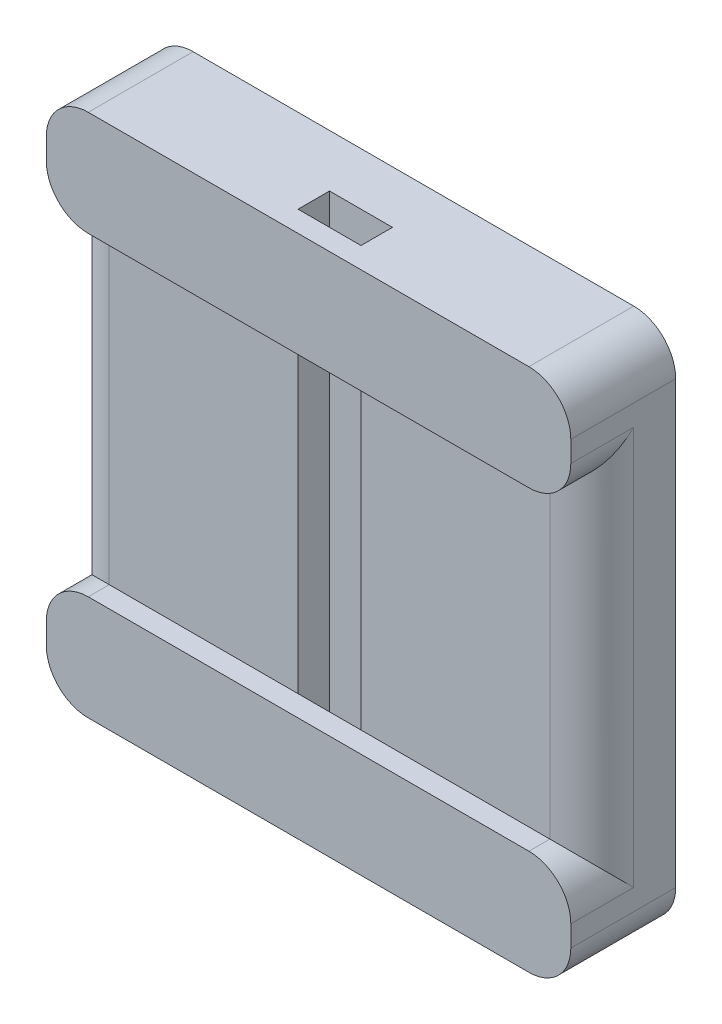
SolidWorks part; units mm, degrees
ref_plane "Plan de face" through (0, 0, 0) normal (0, 0, 1) x (1, 0, 0)
ref_plane "Plan de dessus" through (0, 0, 0) normal (0, 1, 0) x (1, 0, 0)
ref_plane "Plan de droite" through (0, 0, 0) normal (1, 0, 0) x (0, 0, -1)
sketch "Esquisse1" plane through (0, 0, 0) normal (0, 0, 1) x (1, 0, 0)
  line L1 (0, 0) -> (25, 0)
  line L2 (0, 0) -> (0, 25)
  line L3 (0, 25) -> (25, 25)
  line L4 (25, 0) -> (25, 25)
  dimension "D1" = 25
  dimension "D2" = 25
extrude "Boss.-Extru.1" add sketch "Esquisse1" along normal blind 4
sketch "Esquisse2" plane through (0, 0, 4) normal (0, 0, 1) x (1, 0, 0)
  line L0 (0, 20) -> (25, 20)
  line L1 (0, 25) -> (0, 0) construction
  line L2 (25, 0) -> (25, 25) construction
  line L3 (25, 20) -> (25, 25)
  line L4 (25, 25) -> (0, 25)
  line L5 (0, 25) -> (0, 20)
  dimension "D1" = 5
extrude "Boss.-Extru.5" add sketch "Esquisse2" along normal blind 1
sketch "Esquisse5" plane through (0, 0, 4) normal (0, 0, 1) x (1, 0, 0)
  line L0 (0, 5) -> (25, 5)
  line L1 (0, 20) -> (0, 0) construction
  line L2 (25, 0) -> (25, 20) construction
  line L3 (25, 5) -> (25, 0)
  line L4 (25, 0) -> (0, 0)
  line L5 (0, 0) -> (0, 5)
  dimension "D1" = 5
extrude "Boss.-Extru.6" add sketch "Esquisse5" along normal blind 1
sketch "Esquisse7" plane through (0, 0, 0) normal (0, -1, 0) x (1, 0, 0)
  line L0 (25, 5) -> (25, 0) construction
  line L1 (11, 4) -> (14, 4)
  line L2 (11, 4) -> (11, 3)
  line L3 (11, 3) -> (14, 3)
  line L4 (14, 4) -> (14, 3)
  line L5 (0, 0) -> (25, 0) construction
  dimension "D1" = 1
  dimension "D2" = 3
  dimension "D3" = 11
  dimension "D4" = 3
extrude "Enlèv. mat.-Extru.2" cut sketch "Esquisse7" against normal through all
sketch "Esquisse9" plane through (0, 0, 0) normal (0, -1, 0) x (1, 0, 0)
  line L0 (0, 5) -> (0, 0) construction
  line L1 (11, 2.5) -> (14, 2.5)
  line L2 (11, 2.5) -> (11, 3.5)
  line L3 (11, 3.5) -> (14, 3.5)
  line L4 (14, 2.5) -> (14, 3.5)
  line L5 (0, 5) -> (25, 5) construction
  point P4 (11, 3)
  dimension "D1" = 1
  dimension "D2" = 3
  dimension "D3" = 11
  dimension "D4" = 1.5
extrude "Enlèv. mat.-Extru.3" cut sketch "Esquisse9" against normal blind 25
fillet "Congé4" radius 2
fillet "Congé5" radius 2 10 edges at (0, 25, 2.5) (25, 25, 2.5) (25, 0, 2.5) (0, 0, 2.5) (0, 5, 4.5) (0, 12.5, 4) (0, 20, 4.5) (25, 20, 4.5) (25, 12.5, 4) (25, 5, 4.5)
